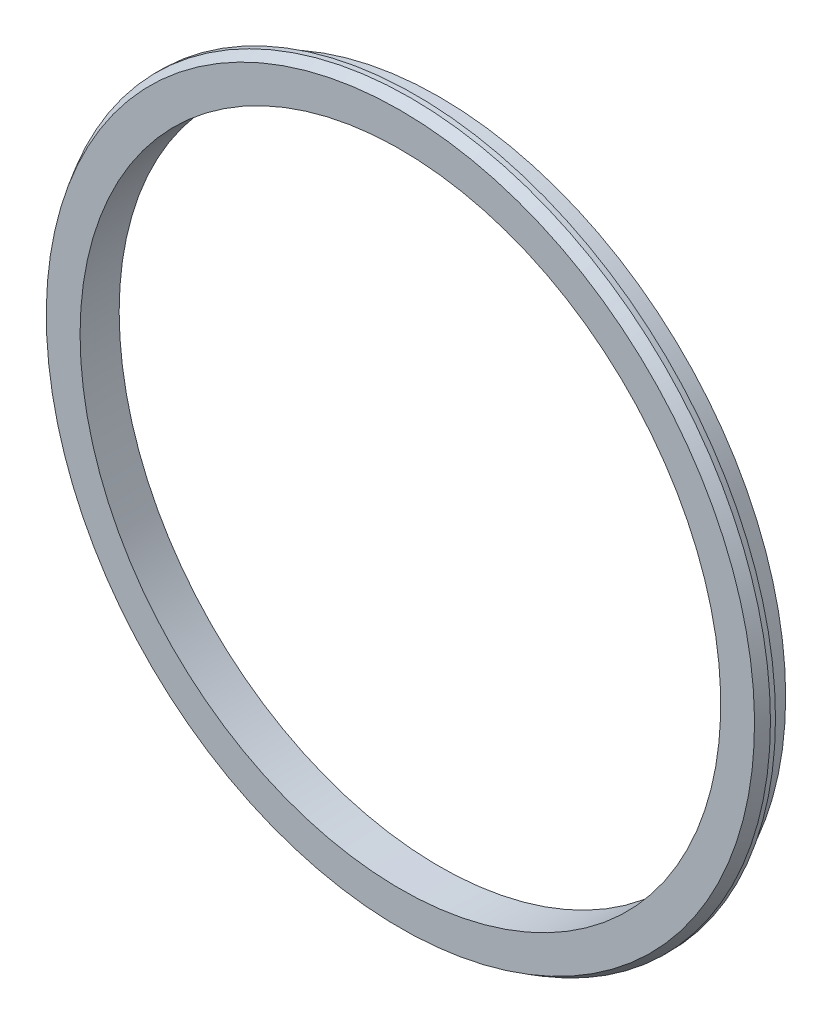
SolidWorks part; units mm, degrees
ref_plane "Front Plane" through (0, 0, 0) normal (0, 0, 1) x (1, 0, 0)
ref_plane "Top Plane" through (0, 0, 0) normal (0, 1, 0) x (1, 0, 0)
ref_plane "Right Plane" through (0, 0, 0) normal (1, 0, 0) x (0, 0, -1)
imported_body "Imported1"
ref_plane "Plane1" through (0, 0, -6.9298) normal (0, 0, 1) x (1, 0, 0)
sketch "Sketch1" plane through (0, 0, -6.9298) normal (0, 0, 1) x (1, 0, 0)
  circle A0 centre (0, 0) radius 138.255
extrude "Cut-Extrude1" cut sketch "Sketch1" against normal through all
sketch "Sketch2" plane through (0, 0, -6.9298) normal (0, 0, -1) x (-1, 0, 0)
  line L0 (0, 62.3462) -> (0, 83.185)
  circle A0 centre (0, 0) radius 62.3462 construction
  circle A1 centre (0, 0) radius 83.185 construction
ref_plane "Plane2" through (0, 0, 0) normal (-1, 0, 0) x (0, 1, 0)
sketch "Sketch5" plane through (0, 0, -6.9298) normal (0, 0, -1) x (-1, 0, 0)
  circle A0 centre (0, 0) radius 63.5
  dimension "D1" = 127
extrude "Cut-Extrude2" cut sketch "Sketch5" against normal through all
sketch "Sketch6" plane through (0, 0, 27.4584) normal (0, 0, 1) x (1, 0, 0)
  circle A0 centre (0, 0) radius 66.675
chamfer "Chamfer2" distance 3.175 angle 45 1 edges at (-63.5, 0, -6.9298)
sketch "Sketch7" plane through (0, 0, -6.9298) normal (0, 0, 1) x (1, 0, 0)
  circle A0 centre (0, 0) radius 95.3595
extrude "Cut-Extrude3" cut sketch "Sketch7" along normal up to surface (26.6384 mm away)
